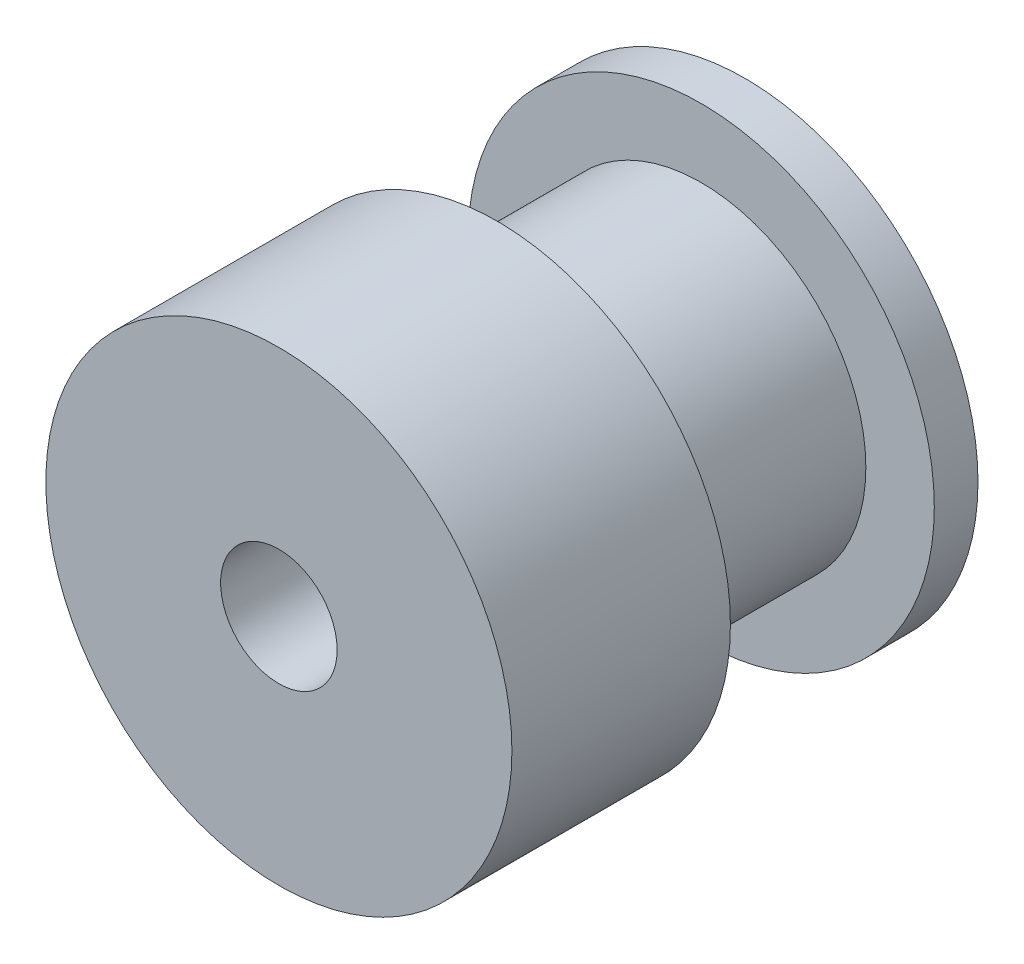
SolidWorks part; units mm, degrees
ref_plane "Alzado" through (0, 0, 0) normal (0, 0, 1) x (1, 0, 0)
ref_plane "Planta" through (0, 0, 0) normal (0, 1, 0) x (1, 0, 0)
ref_plane "Vista lateral" through (0, 0, 0) normal (1, 0, 0) x (0, 0, -1)
sketch "Croquis1" plane through (0, 0, 0) normal (0, 0, 1) x (1, 0, 0)
  circle A0 centre (0, 0) radius 2
  circle A1 centre (0, 0) radius 8
  dimension "D1" = 16
  dimension "D2" = 4
extrude "Saliente-Extruir1" add sketch "Croquis1" along normal blind 1.5
sketch "Croquis2" plane through (0, 0, 1.5) normal (0, 0, 1) x (1, 0, 0)
  circle A0 centre (0, 0) radius 5.65
  circle A1 centre (0, 0) radius 2 construction
  circle A2 centre (0, 0) radius 2
  dimension "D1" = 11.3
extrude "Saliente-Extruir2" add sketch "Croquis2" along normal blind 7
sketch "Croquis3" plane through (0, 0, 8.5) normal (0, 0, 1) x (1, 0, 0)
  circle A0 centre (0, 0) radius 2 construction
  circle A1 centre (0, 0) radius 2
  circle A2 centre (0, 0) radius 8 construction
  circle A3 centre (0, 0) radius 8
extrude "Saliente-Extruir3" add sketch "Croquis3" along normal blind 7.5
